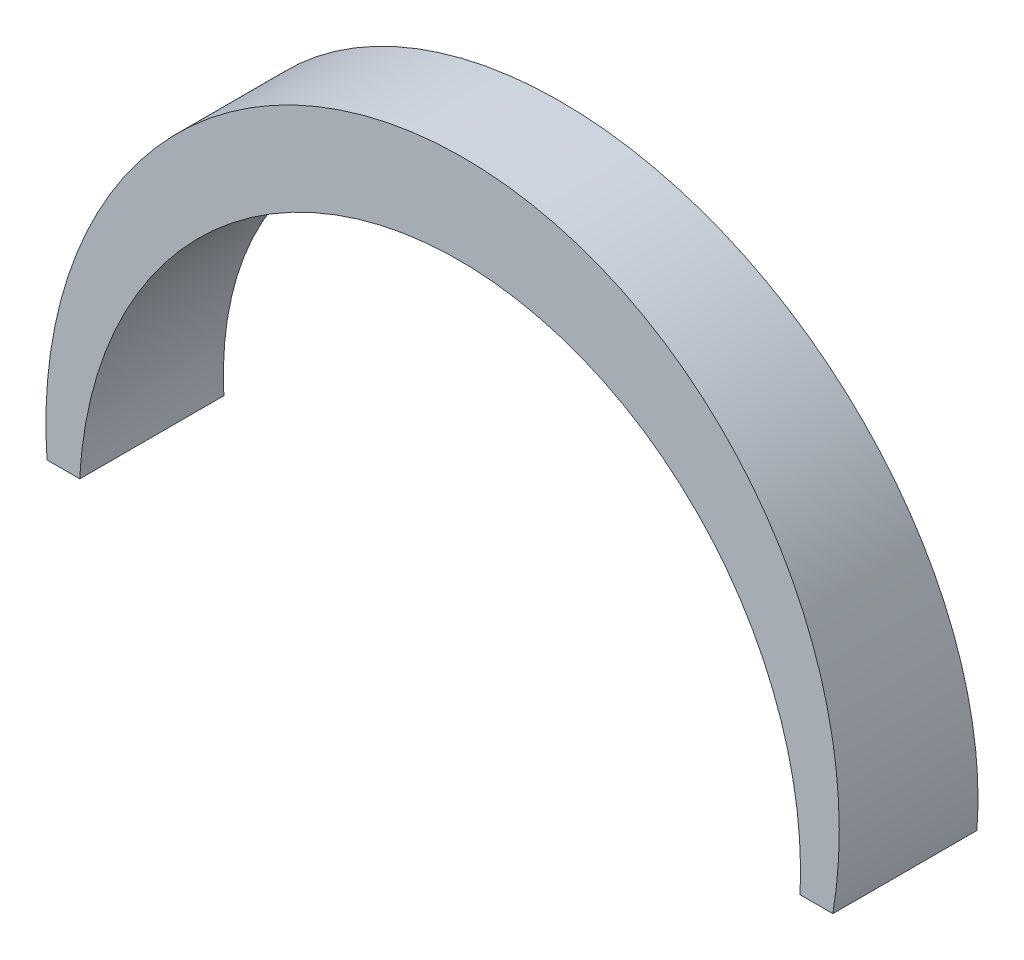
SolidWorks part; units mm, degrees
ref_plane "Ebene vorne" through (0, 0, 0) normal (0, 0, 1) x (1, 0, 0)
ref_plane "Ebene oben" through (0, 0, 0) normal (0, 1, 0) x (1, 0, 0)
ref_plane "Ebene rechts" through (0, 0, 0) normal (1, 0, 0) x (0, 0, -1)
sketch "Skizze1" plane through (0, 0, 0) normal (0, 0, 1) x (1, 0, 0)
  line L0 (-54.5527, 0) -> (-50, 0)
  line L1 (50, 0) -> (54.5527, 0)
  line L2 (0, 0) -> (0, 28.5464) construction
  arc A0 (50, 0) -> (-50, 0) centre (0, 0) ccw
  arc A1 (54.5527, 0) -> (-54.5527, 0) centre (0, 7) ccw
  dimension "D1" = 50
  dimension "D2" = 55
  dimension "D3" = 7
extrude "Linear austragen1" add sketch "Skizze1" along normal blind 10
sketch "Skizze2" plane through (0, 0, 0) normal (1, 0, 0) x (0, 0, -1)
  line L0 (0, 0) -> (-10, 0) construction
  line L1 (-10, 0) -> (-6.1917, 72.6662)
  line L2 (-10, 62) -> (-10, 0) construction
  dimension "D1" = 3
extrude "Schnitt-Linear austragen1" cut sketch "Skizze2" against normal through all and the other way through all
mirror "Spiegeln1" about plane through (0, 0, 0) normal (0, 0, 1) of "Schnitt-Linear austragen1", "Linear austragen1"
equation "\"LÄNGE\"=0"
equation "\"BREITE\"=0"
equation "\"HÖHE\"=0"
equation "\"DURCHMESSER\"=0"
equation "\"Stückzahl\"= 1"
